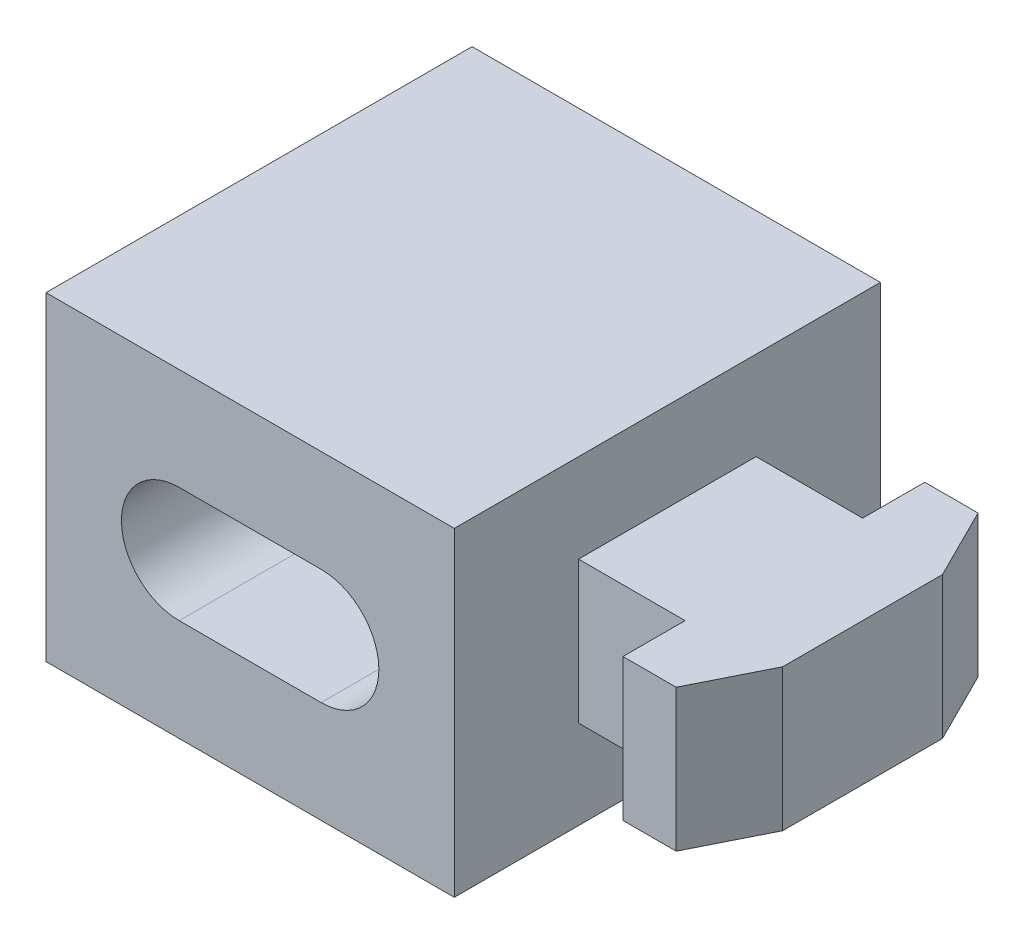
SolidWorks part; units mm, degrees
ref_plane "前视基准面" through (0, 0, 0) normal (0, 0, 1) x (1, 0, 0)
ref_plane "上视基准面" through (0, 0, 0) normal (0, 1, 0) x (1, 0, 0)
ref_plane "右视基准面" through (0, 0, 0) normal (1, 0, 0) x (0, 0, -1)
sketch "草图1" plane through (0, 0, 0) normal (0, 0, 1) x (1, 0, 0)
  line L0 (-4, 0) -> (4, 0) construction
  line L1 (-11.5, 9) -> (11.5, 9)
  line L2 (-11.5, 9) -> (-11.5, -9)
  line L3 (-11.5, -9) -> (11.5, -9)
  line L4 (11.5, 9) -> (11.5, -9)
  line L5 (-4, 3.25) -> (4, 3.25)
  line L6 (-4, -3.25) -> (4, -3.25)
  arc A0 (-4, 3.25) -> (-4, -3.25) centre (-4, 0) ccw
  arc A1 (4, -3.25) -> (4, 3.25) centre (4, 0) ccw
  point P8 (0, 0)
  dimension "D4" = 3.25
  dimension "D5" = 7.5
  dimension "D1" = 23
  dimension "D2" = 18
  dimension "D3" = 11.5
  dimension "D6" = 8
extrude "凸台-拉伸1" add sketch "草图1" along normal mid plane 24
sketch "草图2" plane through (-11.5, 0, 0) normal (-1, 0, 0) x (0, 0, 1)
  line L1 (-2.5, 5) -> (2.5, 5)
  line L2 (-2.5, 5) -> (-2.5, -5)
  line L3 (-2.5, -5) -> (2.5, -5)
  line L4 (2.5, 5) -> (2.5, -5)
  dimension "D1" = 5
  dimension "D2" = 10
  dimension "D3" = 2.5
extrude "切除-拉伸1" cut sketch "草图2" against normal blind 20
sketch "草图4" plane through (11.5, 0, 0) normal (1, 0, 0) x (0, 0, -1)
  line L1 (-8.5, 4) -> (8.5, 4)
  line L2 (-8.5, 4) -> (-8.5, -4)
  line L3 (-8.5, -4) -> (8.5, -4)
  line L4 (8.5, 4) -> (8.5, -4)
  dimension "D1" = 17
  dimension "D2" = 8
extrude "凸台-拉伸2" add sketch "草图4" along normal blind 11
sketch "草图5" plane through (0, 4, 0) normal (0, 1, 0) x (1, 0, 0)
  line L1 (11.5, 8.5) -> (17.5, 8.5)
  line L2 (11.5, 8.5) -> (11.5, 5)
  line L3 (11.5, 5) -> (17.5, 5)
  line L4 (17.5, 8.5) -> (17.5, 5)
  dimension "D1" = 6
  dimension "D2" = 3.5
extrude "切除-拉伸2" cut sketch "草图5" against normal through all
mirror "镜向1" about plane through (0, 0, 0) normal (0, 0, 1) of "切除-拉伸2"
sketch "草图6" plane through (0, -4, 0) normal (0, -1, 0) x (1, 0, 0)
  line L0 (20.5, 8.5) -> (22.5, 8.5)
  line L1 (22.5, 8.5) -> (17.5, 8.5) construction
  line L2 (22.5, 8.5) -> (22.5, 4.5)
  line L3 (22.5, 8.5) -> (22.5, -8.5) construction
  line L4 (22.5, 4.5) -> (20.5, 8.5)
  dimension "D1" = 2
  dimension "D2" = 4
extrude "切除-拉伸3" cut sketch "草图6" against normal blind 11
mirror "镜向2" about plane through (0, 0, 0) normal (0, 0, 1) of "切除-拉伸3"
